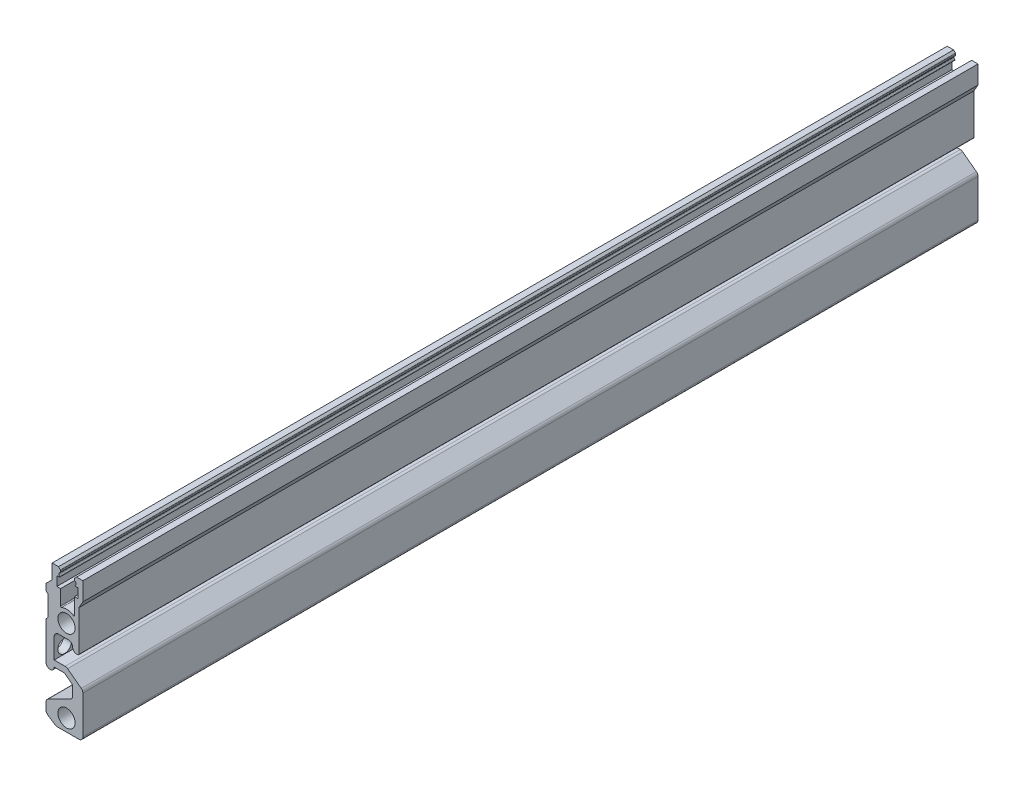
SolidWorks part; units mm, degrees
ref_plane "前视基准面" through (0, 0, 0) normal (0, 0, 1) x (1, 0, 0)
ref_plane "上视基准面" through (0, 0, 0) normal (0, 1, 0) x (1, 0, 0)
ref_plane "右视基准面" through (0, 0, 0) normal (1, 0, 0) x (0, 0, -1)
sketch "草图1" plane through (0, 0, 0) normal (0, 0, 1) x (1, 0, 0)
  line L0 (-2.3509, 8.9116) -> (-2.3509, 6.6116)
  line L1 (-2.3509, 8.9116) -> (-1.4509, 8.9116)
  line L2 (-1.4509, 8.9116) -> (-1.4509, 11.7916)
  line L3 (-1.4509, 11.7916) -> (-4.1259, 11.7916)
  line L4 (-4.1259, 11.7916) -> (-4.1259, 10.0616)
  line L5 (-4.1259, 10.0616) -> (-3.5009, 9.8916)
  line L6 (-3.5009, 9.8916) -> (-3.5009, 8.5216)
  line L7 (-3.5009, 8.5216) -> (-5.0009, 8.5216)
  line L8 (-5.0009, 8.5216) -> (-5.0009, 4.4416)
  line L9 (-5.0009, 4.4416) -> (-4.5507, 3.9414)
  line L10 (-4.5507, 3.9414) -> (-4.551, -1.0586)
  line L11 (-4.551, -1.0586) -> (-5.0009, -1.5584)
  line L12 (-5.0009, -1.5584) -> (-5.0009, -10.75)
  line L13 (-3.0009, -9.25) -> (-3.0009, -5.75)
  line L14 (2.9991, -5.05) -> (2.9991, -2.0584)
  line L15 (3.2991, -1.7584) -> (3.6991, -1.7584)
  line L16 (3.9991, -2.0584) -> (3.9991, -3.4584)
  line L17 (4.2991, -3.7584) -> (4.6991, -3.7584)
  line L18 (4.9991, -3.4584) -> (4.9991, 2.6416)
  line L19 (4.6991, 2.9416) -> (4.2991, 2.9416)
  line L20 (3.9991, 2.6416) -> (3.9991, 1.2416)
  line L21 (3.6991, 0.9416) -> (3.2991, 0.9416)
  line L22 (2.9991, 1.2416) -> (2.9991, 4.8054)
  line L23 (2.9991, 4.8054) -> (3.9991, 6.5374)
  line L24 (3.9991, 6.5374) -> (3.9991, 9.5216)
  line L25 (3.9991, 9.5216) -> (3.1241, 9.5216)
  line L26 (3.1241, 10.7916) -> (3.1241, 11.7916)
  line L27 (3.1241, 11.7916) -> (1.9491, 11.7916)
  line L28 (1.9491, 11.7916) -> (1.9491, 8.9116)
  line L29 (1.9491, 8.9116) -> (2.8491, 8.9116)
  line L30 (2.8491, 6.6116) -> (2.8491, 8.9116)
  line L31 (2.8491, 6.6116) -> (1.9491, 6.6116)
  line L32 (1.9491, 6.6116) -> (1.9491, 2.6797)
  line L33 (-1.4509, 2.9454) -> (-1.4509, 6.6116)
  line L34 (-1.4509, 6.6116) -> (-2.3509, 6.6116)
  line L35 (0, 0) -> (0, -5) construction
  line L39 (-2.5009, -5.25) -> (2.7991, -5.25)
  line L40 (-1.4509, 10.3516) -> (1.9491, 10.3516) construction
  line L41 (-3.0009, -10.75) -> (-5.0009, -10.75) construction
  line L42 (0.2491, 10.3516) -> (0.2491, 6.8507) construction
  line L43 (1.4991, -10.75) -> (1.4991, -17.25)
  line L44 (2.9991, -10.05) -> (2.9991, -22.2)
  line L45 (-3.0009, -10.75) -> (1.4991, -10.75)
  line L46 (-3.0009, -9.25) -> (2.1991, -9.25)
  line L47 (-5.0009, -22.2) -> (-5.0009, -18.05)
  line L48 (2.1991, -23) -> (-4.2009, -23)
  line L49 (-4.2009, -17.25) -> (1.4991, -17.25)
  arc A1 (3.2991, -1.7584) -> (2.9991, -2.0584) centre (3.2991, -2.0584) ccw
  arc A2 (3.9991, -2.0584) -> (3.6991, -1.7584) centre (3.6991, -2.0584) ccw
  arc A3 (3.9991, -3.4584) -> (4.2991, -3.7584) centre (4.2991, -3.4584) ccw
  arc A4 (4.6991, -3.7584) -> (4.9991, -3.4584) centre (4.6991, -3.4584) ccw
  arc A5 (4.9991, 2.6416) -> (4.6991, 2.9416) centre (4.6991, 2.6416) ccw
  arc A6 (4.2991, 2.9416) -> (3.9991, 2.6416) centre (4.2991, 2.6416) ccw
  arc A7 (3.6991, 0.9416) -> (3.9991, 1.2416) centre (3.6991, 1.2416) ccw
  arc A8 (2.9991, 1.2416) -> (3.2991, 0.9416) centre (3.2991, 1.2416) ccw
  arc A9 (3.1241, 10.7916) -> (3.1241, 9.5216) centre (3.1841, 10.1566) ccw
  circle A10 centre (0, 0) radius 1.6
  arc A11 (1.6398, 2.5122) -> (-1.1727, 2.7613) centre (0, 0) ccw
  arc A12 (1.6398, 2.5122) -> (1.9491, 2.6797) centre (1.7491, 2.6797) ccw
  arc A13 (-1.4509, 2.9454) -> (-1.1727, 2.7613) centre (-1.2509, 2.9454) ccw
  arc A17 (-4.2009, -17.25) -> (-5.0009, -18.05) centre (-4.2009, -18.05) ccw
  arc A18 (2.1991, -23) -> (2.9991, -22.2) centre (2.1991, -22.2) ccw
  arc A19 (2.7991, -5.25) -> (2.9991, -5.05) centre (2.7991, -5.05) ccw
  arc A20 (-3.0009, -5.75) -> (-2.5009, -5.25) centre (-2.5009, -5.75) cw
  circle A21 centre (0, -20) radius 1.6
  arc A22 (-5.0009, -22.2) -> (-4.2009, -23) centre (-4.2009, -22.2) ccw
  arc A23 (2.9991, -10.05) -> (2.1991, -9.25) centre (2.1991, -10.05) ccw
  arc A28 (-5.0009, -10.75) -> (-3.0009, -10.75) centre (-4.0009, -10.75) ccw
  dimension "D3" = 1.5
  dimension "D6" = 3.2
  dimension "D7" = 20
  dimension "D17" = 0.8
  dimension "D18" = 0.8
  dimension "D19" = 0.8
  dimension "D20" = 0.8
  dimension "D5" = 5.2
  dimension "D8" = 1
  dimension "D10" = 34.7916
  dimension "D12" = 5.75
  dimension "D13" = 13.75
  dimension "D16" = 8
extrude "凸台-拉伸1" add sketch "草图1" along normal mid plane 218.44
sketch "草图2" plane through (0, 0, -109.22) normal (0, 0, -1) x (-1, 0, 0)
  circle A0 centre (0, 0) radius 2.1
  circle A1 centre (0, -20) radius 2.1
  dimension "D1" = 4.2
  dimension "D2" = 4.2
extrude "切除-拉伸1" cut sketch "草图2" against normal blind 10
sketch "草图3" plane through (0, 0, 109.22) normal (0, 0, 1) x (1, 0, 0)
  circle A0 centre (0, 0) radius 2.1
  circle A1 centre (0, -20) radius 2.1
  dimension "D1" = 4.2
  dimension "D2" = 4.2
extrude "切除-拉伸2" cut sketch "草图3" against normal blind 10
sketch "草图4" plane through (-5.0009, 0, 0) normal (-1, 0, 0) x (0, 0, 1)
  line L0 (-109.22, -1.5584) -> (-109.22, -10.75) construction
  line L2 (-109.22, -11.75) -> (109.22, -11.75) construction
  circle A0 centre (-106.68, -7.5) radius 1.65
  circle A1 centre (-101.6, -7.5) radius 1.65
  circle A2 centre (-96.52, -7.5) radius 1.65
  circle A3 centre (-91.44, -7.5) radius 1.65
  circle A4 centre (-86.36, -7.5) radius 1.65
  circle A5 centre (-81.28, -7.5) radius 1.65
  circle A6 centre (-76.2, -7.5) radius 1.65
  circle A7 centre (-71.12, -7.5) radius 1.65
  circle A8 centre (-66.04, -7.5) radius 1.65
  circle A9 centre (-60.96, -7.5) radius 1.65
  circle A10 centre (-55.88, -7.5) radius 1.65
  circle A11 centre (-50.8, -7.5) radius 1.65
  circle A12 centre (-45.72, -7.5) radius 1.65
  circle A13 centre (-40.64, -7.5) radius 1.65
  circle A14 centre (-35.56, -7.5) radius 1.65
  circle A15 centre (-30.48, -7.5) radius 1.65
  circle A16 centre (-25.4, -7.5) radius 1.65
  circle A17 centre (-20.32, -7.5) radius 1.65
  circle A18 centre (-15.24, -7.5) radius 1.65
  circle A19 centre (-10.16, -7.5) radius 1.65
  circle A20 centre (-5.08, -7.5) radius 1.65
  circle A21 centre (0, -7.5) radius 1.65
  circle A22 centre (5.08, -7.5) radius 1.65
  circle A23 centre (10.16, -7.5) radius 1.65
  circle A24 centre (15.24, -7.5) radius 1.65
  circle A25 centre (20.32, -7.5) radius 1.65
  circle A26 centre (25.4, -7.5) radius 1.65
  circle A27 centre (30.48, -7.5) radius 1.65
  circle A28 centre (35.56, -7.5) radius 1.65
  circle A29 centre (40.64, -7.5) radius 1.65
  circle A30 centre (45.72, -7.5) radius 1.65
  circle A31 centre (50.8, -7.5) radius 1.65
  circle A32 centre (55.88, -7.5) radius 1.65
  circle A33 centre (60.96, -7.5) radius 1.65
  circle A34 centre (66.04, -7.5) radius 1.65
  circle A35 centre (71.12, -7.5) radius 1.65
  circle A36 centre (76.2, -7.5) radius 1.65
  circle A37 centre (81.28, -7.5) radius 1.65
  circle A38 centre (86.36, -7.5) radius 1.65
  circle A39 centre (91.44, -7.5) radius 1.65
  circle A40 centre (96.52, -7.5) radius 1.65
  circle A41 centre (101.6, -7.5) radius 1.65
  circle A42 centre (106.68, -7.5) radius 1.65
  circle A43 centre (111.76, -7.5) radius 1.65
  circle A44 centre (116.84, -7.5) radius 1.65
  circle A45 centre (121.92, -7.5) radius 1.65
  circle A46 centre (127, -7.5) radius 1.65
  circle A47 centre (132.08, -7.5) radius 1.65
  circle A48 centre (137.16, -7.5) radius 1.65
  circle A49 centre (142.24, -7.5) radius 1.65
  circle A50 centre (147.32, -7.5) radius 1.65
  circle A51 centre (152.4, -7.5) radius 1.65
  circle A52 centre (157.48, -7.5) radius 1.65
  circle A53 centre (162.56, -7.5) radius 1.65
  circle A54 centre (167.64, -7.5) radius 1.65
  circle A55 centre (172.72, -7.5) radius 1.65
  circle A56 centre (177.8, -7.5) radius 1.65
  circle A57 centre (182.88, -7.5) radius 1.65
  circle A58 centre (187.96, -7.5) radius 1.65
  circle A59 centre (193.04, -7.5) radius 1.65
  circle A60 centre (198.12, -7.5) radius 1.65
  circle A61 centre (203.2, -7.5) radius 1.65
  circle A62 centre (208.28, -7.5) radius 1.65
  circle A63 centre (213.36, -7.5) radius 1.65
  circle A64 centre (218.44, -7.5) radius 1.65
  circle A65 centre (223.52, -7.5) radius 1.65
  circle A66 centre (228.6, -7.5) radius 1.65
  circle A67 centre (233.68, -7.5) radius 1.65
  circle A68 centre (238.76, -7.5) radius 1.65
  circle A69 centre (243.84, -7.5) radius 1.65
  circle A70 centre (248.92, -7.5) radius 1.65
  circle A71 centre (254, -7.5) radius 1.65
  circle A72 centre (259.08, -7.5) radius 1.65
  circle A73 centre (264.16, -7.5) radius 1.65
  circle A74 centre (269.24, -7.5) radius 1.65
  circle A75 centre (274.32, -7.5) radius 1.65
  circle A76 centre (279.4, -7.5) radius 1.65
  circle A77 centre (284.48, -7.5) radius 1.65
  circle A78 centre (289.56, -7.5) radius 1.65
  circle A79 centre (294.64, -7.5) radius 1.65
  circle A80 centre (299.72, -7.5) radius 1.65
  circle A81 centre (304.8, -7.5) radius 1.65
  circle A82 centre (309.88, -7.5) radius 1.65
  circle A83 centre (314.96, -7.5) radius 1.65
  circle A84 centre (320.04, -7.5) radius 1.65
  dimension "D1" = 3.3
  dimension "D5" = 5.08
  dimension "D3" = 4.25
  dimension "D2" = 2.54
  dimension "D4" = 85
extrude "切除-拉伸3" cut sketch "草图4" against normal blind 12
sketch "草图5" plane through (0, 0, 109.22) normal (0, 0, 1) x (1, 0, 0)
  line L0 (1.9491, 8.9116) -> (2.8491, 8.9116) construction
  line L1 (1.9491, 8.9116) -> (3.9991, 8.9116)
  line L2 (1.9491, 8.9116) -> (1.9491, 11.7916)
  line L3 (1.9491, 11.7916) -> (3.9991, 11.7916)
  line L4 (3.9991, 8.9116) -> (3.9991, 11.7916)
  line L5 (3.1241, 11.7916) -> (1.9491, 11.7916) construction
  line L6 (3.9991, 6.5374) -> (3.9991, 9.5216) construction
  line L7 (-1.4509, 11.7916) -> (-4.1259, 11.7916) construction
  line L8 (-5.0009, 8.5216) -> (-2.7884, 8.5216)
  line L9 (-5.0009, 8.5216) -> (-5.0009, 11.7916)
  line L10 (-5.0009, 11.7916) -> (-2.7884, 11.7916)
  line L11 (-2.7884, 8.5216) -> (-2.7884, 11.7916)
extrude "凸台-拉伸2" add sketch "草图5" against normal up to surface (218.44 mm away)
sketch "草图6" plane through (0, 0, -109.22) normal (0, 0, -1) x (-1, 0, 0)
  line L0 (-1.9491, 9.4916) -> (1.4509, 9.4916) construction
  line L1 (-1.9491, 11.7916) -> (-1.9491, 8.9116) construction
  line L2 (1.4509, 8.9116) -> (1.4509, 11.7916) construction
  line L3 (1.4509, 11.7916) -> (5.0009, 11.7916) construction
  line L4 (-2.3491, 8.9916) -> (1.8509, 8.9916)
  line L5 (-2.3491, 8.9916) -> (-2.3491, 9.9916)
  line L6 (-2.3491, 9.9916) -> (1.8509, 9.9916)
  line L7 (1.8509, 8.9916) -> (1.8509, 9.9916)
  line L8 (-2.3491, 8.9916) -> (1.8509, 9.9916) construction
  line L9 (-2.3491, 9.9916) -> (1.8509, 8.9916) construction
  point P6 (-0.2491, 9.4916)
  dimension "D1" = 1
  dimension "D2" = 4.2
  dimension "D3" = 1.8
extrude "切除-拉伸4" cut sketch "草图6" against normal through all
sketch "草图8" plane through (0, 0, -109.22) normal (0, 0, -1) x (-1, 0, 0)
  line L0 (5.0009, 11.7916) -> (5.0009, 4.4416) construction
  line L1 (-3.9991, 11.7916) -> (5.0009, 11.7916)
  line L2 (-3.9991, 11.7916) -> (-3.9991, 11.0016)
  line L3 (-3.9991, 11.0016) -> (5.0009, 11.0016)
  line L4 (5.0009, 11.7916) -> (5.0009, 11.0016)
  dimension "D1" = 0.79
extrude "切除-拉伸6" cut sketch "草图8" against normal through all
fillet "圆角1" radius 0.5 4 edges at (-1.8509, 9.9916, 0) (-1.8509, 8.9916, 0) (2.3491, 9.9916, 0) (2.3491, 8.9916, 0)
chamfer "倒角1" distance 0.5 angle 45 2 edges at (-1.4509, 11.0016, 0) (1.9491, 11.0016, 0)
fillet "圆角2" radius 0.2 6 edges at (1.9491, 10.5016, 0) (-1.4509, 10.5016, 0) (-1.4509, 8.9916, 0) (-1.4509, 9.9916, 0) (1.9491, 8.9916, 0) (1.9491, 9.9916, 0)
fillet "圆角3" radius 0.1 2 edges at (-1.4509, 8.9116, 0) (1.9491, 8.9116, 0)
sketch "草图7" plane through (0, 0, -109.22) normal (0, 0, -1) x (-1, 0, 0)
  line L0 (5.0009, 11.0016) -> (3.5009, 11.0016)
  line L2 (3.5009, 11.0016) -> (3.5009, 7.4416)
  line L3 (3.5009, 7.4416) -> (5.0009, 5.9416)
  line L4 (5.0009, 11.0016) -> (5.0009, 4.4416) construction
  line L5 (5.0009, 5.9416) -> (5.0009, 11.0016)
  line L6 (1.4509, 10.1341) -> (1.4509, 10.4187) construction
  line L7 (1.9509, 11.0016) -> (5.0009, 11.0016) construction
  dimension "D1" = 2.05
  dimension "D2" = 1.5
  dimension "D3" = 45
extrude "切除-拉伸5" cut sketch "草图7" against normal through all
sketch "草图10" plane through (0, 0, -109.22) normal (0, 0, -1) x (-1, 0, 0)
  line L0 (5.0009, -19.75) -> (1.0009, -23)
  line L3 (5.0009, -18.05) -> (5.0009, -22.2) construction
  line L4 (4.2009, -23) -> (-2.1991, -23) construction
  line L5 (1.0009, -23) -> (6.263, -23)
  line L6 (6.263, -23) -> (6.263, -19.75)
  line L7 (6.263, -19.75) -> (5.0009, -19.75)
  line L8 (-1.4991, -17.25) -> (4.2009, -17.25) construction
  dimension "D1" = 2.5
  dimension "D2" = 4
extrude "切除-拉伸7" [suppressed] cut sketch "草图10" against normal through all
fillet "圆角4" [suppressed] radius 0.8
sketch "草图11" plane through (0, 0, -109.22) normal (0, 0, -1) x (-1, 0, 0)
  line L2 (5.0009, -18.05) -> (5.0009, -22.2) construction
  line L7 (5.0009, -21.375) -> (5.0009, -23)
  line L8 (5.0009, -23) -> (2.5009, -23)
  line L9 (4.2009, -23) -> (-2.1991, -23) construction
  line L10 (2.5009, -23) -> (5.0009, -21.375)
  line L11 (5.0009, -20.125) -> (-2.9991, -20.125) construction
  line L12 (-2.9991, -22.2) -> (-2.9991, -10.05) construction
  line L13 (3.0009, -6.25) -> (3.0009, -3.25)
  line L14 (3.0009, -9.25) -> (3.0009, -5.75) construction
  line L15 (3.0009, -3.25) -> (-1.4991, -3.25)
  line L16 (-1.4991, -3.25) -> (-1.4991, -6.25)
  line L17 (3.0009, -6.25) -> (-1.4991, -6.25)
  line L18 (2.5009, -5.25) -> (-2.7991, -5.25) construction
  line L20 (-2.9991, -5.05) -> (-2.9991, -2.0584) construction
  dimension "D1" = 1.625
  dimension "D4" = 5.5
  dimension "D5" = 2
  dimension "D6" = 3
  dimension "D7" = 1.5
extrude "切除-拉伸8" cut sketch "草图11" against normal through all
sketch "草图12" plane through (0, 0, -109.22) normal (0, 0, -1) x (-1, 0, 0)
  line L0 (2.5009, -17.25) -> (-1.4991, -17.25)
  line L1 (-1.4991, -17.25) -> (-1.4991, -15.25)
  line L2 (-1.4991, -15.25) -> (2.5009, -17.25)
  line L3 (0.5009, -10.75) -> (-1.4991, -12.25)
  line L4 (3.0009, -10.75) -> (-1.4991, -10.75) construction
  line L5 (-1.4991, -10.75) -> (-1.4991, -17.25) construction
  line L6 (-1.4991, -12.25) -> (-1.4991, -10.75)
  line L7 (-1.4991, -10.75) -> (0.5009, -10.75)
  dimension "D1" = 2
  dimension "D2" = 1.5
  dimension "D3" = 2
extrude "凸台-拉伸3" add sketch "草图12" against normal through all
sketch "草图14" plane through (0, 0, -109.22) normal (0, 0, -1) x (-1, 0, 0)
  line L0 (0.0009, -9.25) -> (-2.9991, -11.5)
  line L1 (-2.1991, -9.25) -> (3.0009, -9.25) construction
  line L2 (-2.9991, -22.2) -> (-2.9991, -10.05) construction
  line L3 (-2.9991, -11.5) -> (-2.9991, -9.25)
  line L4 (-2.9991, -9.25) -> (0.0009, -9.25)
  line L5 (-1.4991, -12.25) -> (0.5009, -10.75) construction
  line L6 (2.5009, -17.25) -> (5.961, -18.98)
  line L7 (5.961, -18.98) -> (5.961, -16.25)
  line L8 (5.961, -16.25) -> (2.5009, -17.25)
  dimension "D1" = 1.5
extrude "切除-拉伸10" cut sketch "草图14" against normal through all
fillet "圆角6" radius 1 10 edges at (-5.0009, -21.375, 0) (-5.0009, -18.5, 0) (1.4991, -15.25, 0) (-2.5009, -23, 0) (-0.5009, -10.75, 0) (2.9991, -11.5, 0) (-0.0009, -9.25, 0) (-3.0009, -3.25, 0) (1.4991, -3.25, 0) (1.4991, -5.25, 0)
sketch "草图15" plane through (0, 0, -109.22) normal (0, 0, -1) x (-1, 0, 0)
  line L0 (-2.1991, -23) -> (-2.9991, -23)
  line L1 (-2.9991, -23) -> (-2.9991, -22.2)
  line L2 (-2.9991, -22.2) -> (-2.1991, -23)
  line L3 (2.2044, -23) -> (-2.1991, -23) construction
  line L4 (-2.9991, -12) -> (-2.5991, -11.2)
  line L5 (-2.5991, -11.2) -> (-2.9991, -11.5)
  line L6 (-2.9991, -12) -> (-2.9991, -11.5)
extrude "凸台-拉伸4" add sketch "草图15" against normal through all
sketch "草图16" plane through (0, 0, -109.22) normal (0, 0, -1) x (-1, 0, 0)
  line L0 (-2.9991, -11.5) -> (-3.9991, -12.25)
  line L1 (-2.9991, -23) -> (-3.9991, -23)
  line L2 (-2.9991, -23) -> (-2.9991, -11.5)
  line L3 (-2.9991, -11.5) -> (-0.2658, -9.45) construction
  line L4 (-3.9991, -23) -> (-3.9991, -12.25)
  dimension "D1" = 1
extrude "凸台-拉伸5" add sketch "草图16" against normal through all
fillet "圆角7" radius 1 2 edges at (3.9991, -12.25, 0) (3.9991, -23, 0)
sketch "草图17" plane through (0, 0, -109.22) normal (0, 0, -1) x (-1, 0, 0)
  line L0 (-2.9991, -5.05) -> (-2.9991, -2.0584) construction
  line L1 (-2.9991, -6.1776) -> (-6.0043, -6.1776)
  line L2 (-2.9991, -6.1776) -> (-2.9991, 3.4413)
  line L3 (-2.9991, 3.4413) -> (-6.0043, 3.4413)
  line L4 (-6.0043, -6.1776) -> (-6.0043, 3.4413)
  line L5 (-2.9991, 1.2416) -> (-2.9991, 4.8054) construction
extrude "切除-拉伸11" cut sketch "草图17" against normal through all
